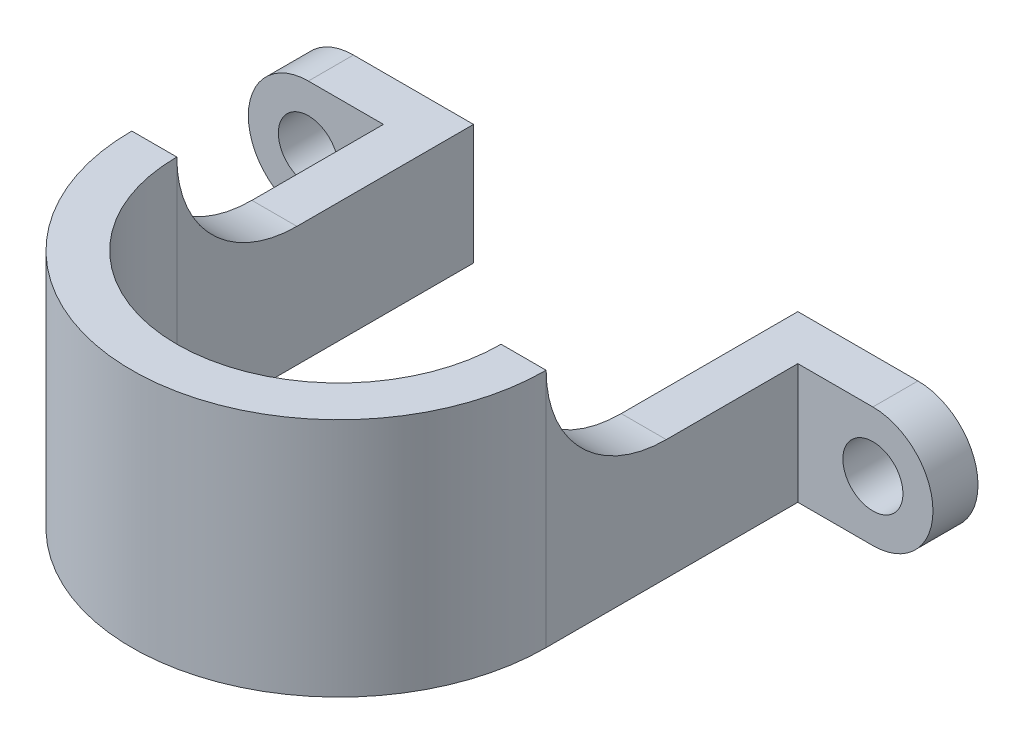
SolidWorks part; units mm, degrees
ref_plane "Front Plane" through (0, 0, 0) normal (0, 0, 1) x (1, 0, 0)
ref_plane "Top Plane" through (0, 0, 0) normal (0, 1, 0) x (1, 0, 0)
ref_plane "Right Plane" through (0, 0, 0) normal (1, 0, 0) x (0, 0, -1)
sketch "Sketch1" plane through (0, 976.0294, 0) normal (0, -1, 0) x (1, 0, 0)
  line L0 (366.1132, 1255.113) -> (366.1132, 1286.4871)
  line L1 (400.4032, 1286.4871) -> (400.4032, 1255.113)
  line L2 (366.1132, 1255.113) -> (361.3507, 1255.113)
  line L3 (366.1132, 1255.113) -> (353.4132, 1255.113) construction
  line L4 (361.3507, 1255.113) -> (361.3507, 1286.4871)
  line L5 (400.4032, 1255.113) -> (405.1657, 1255.113)
  line L6 (413.1032, 1255.113) -> (400.4032, 1255.113) construction
  line L7 (405.1657, 1255.113) -> (405.1657, 1286.4871)
  circle A0 centre (383.2582, 1286.4871) radius 17.145 construction
  arc A1 (400.4032, 1286.4871) -> (366.1132, 1286.4871) centre (383.2582, 1286.4871) ccw
  arc A2 (361.3507, 1286.4871) -> (405.1657, 1286.4871) centre (383.2582, 1286.4871) cw
  dimension "D1" = 4.7625
  dimension "D2" = 4.7625
extrude "Boss-Extrude1" add sketch "Sketch1" against normal up to surface (12.7 mm away)
sketch "Sketch2" plane through (0, 0, 1255.113) normal (0, 0, 1) x (1, 0, 0)
  line L0 (361.3507, 988.7294) -> (353.4132, 988.7294)
  line L1 (353.4132, 976.0294) -> (361.3507, 976.0294)
  line L2 (361.3507, 976.0294) -> (361.3507, 988.7294)
  line L3 (383.2582, 988.7294) -> (383.2582, 976.0294) construction
  line L4 (405.1657, 988.7294) -> (361.3507, 988.7294) construction
  line L5 (361.3507, 976.0294) -> (405.1657, 976.0294) construction
  line L6 (405.1657, 976.0294) -> (405.1657, 988.7294)
  line L7 (413.1032, 976.0294) -> (405.1657, 976.0294)
  line L8 (405.1657, 988.7294) -> (413.1032, 988.7294)
  arc A0 (353.4132, 988.7294) -> (353.4132, 976.0294) centre (353.4132, 982.3794) ccw
  circle A1 centre (353.4132, 982.3794) radius 3.175
  circle A2 centre (353.4132, 982.3794) radius 3.175 construction
  circle A3 centre (413.1032, 982.3794) radius 3.175
  arc A4 (413.1032, 988.7294) -> (413.1032, 976.0294) centre (413.1032, 982.3794) cw
extrude "Boss-Extrude2" add sketch "Sketch2" along normal blind 4.7625
sketch "Sketch3" plane through (0, 988.7294, 0) normal (0, 1, 0) x (1, 0, 0)
  line L0 (361.3507, -1286.4871) -> (366.1132, -1286.4871)
  line L1 (405.1657, -1286.4871) -> (400.4032, -1286.4871)
  arc A0 (361.3507, -1286.4871) -> (405.1657, -1286.4871) centre (383.2582, -1286.4871) ccw construction
  arc A1 (400.4032, -1286.4871) -> (366.1132, -1286.4871) centre (383.2582, -1286.4871) cw
  arc A2 (405.1657, -1286.4871) -> (361.3507, -1286.4871) centre (383.2582, -1286.4871) cw
  arc A3 (366.1132, -1286.4871) -> (400.4032, -1286.4871) centre (383.2582, -1286.4871) ccw construction
extrude "Boss-Extrude3" add sketch "Sketch3" along normal up to vertex
fillet "Fillet1" radius 12.7 2 edges at (363.7319, 988.7294, 1286.4871) (402.7844, 988.7294, 1286.4871)
